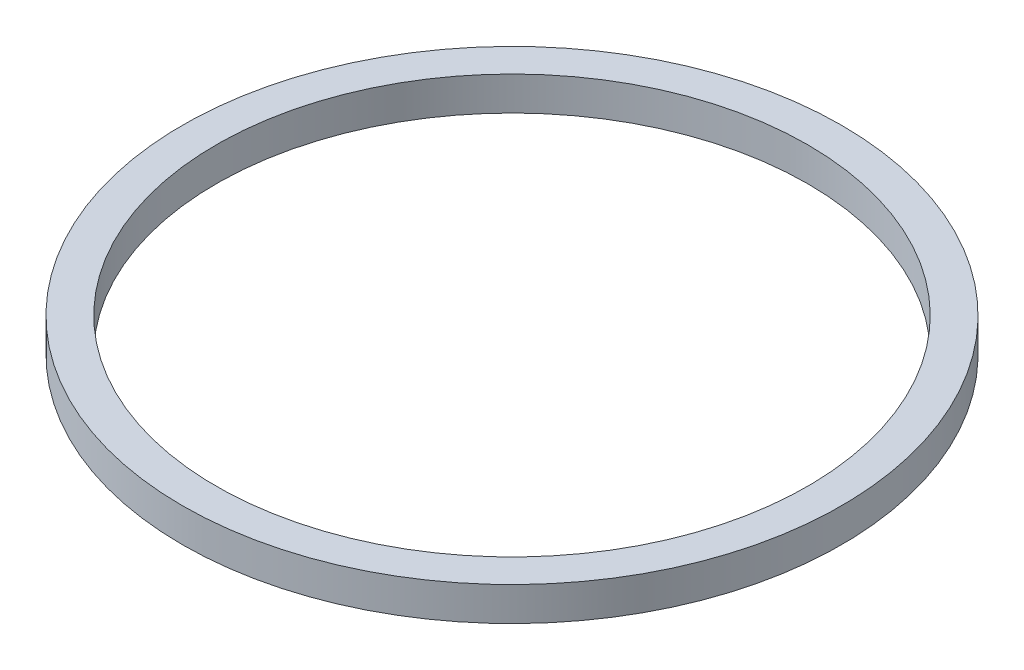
SolidWorks part; units mm, degrees
ref_plane "Front" through (0, 0, 0) normal (0, 0, 1) x (1, 0, 0)
ref_plane "Top" through (0, 0, 0) normal (0, 1, 0) x (1, 0, 0)
ref_plane "Right" through (0, 0, 0) normal (1, 0, 0) x (0, 0, -1)
sketch "Sketch1" plane through (0, 0, 0) normal (0, 0, 1) x (1, 0, 0)
  line L0 (0, 0) -> (0, 36.9957) construction
  line L2 (70, 8) -> (78, 8)
  line L3 (70, 8) -> (70, 0)
  line L4 (70, 0) -> (78, 0)
  line L5 (78, 8) -> (78, 0)
  dimension "D1" = 8
  dimension "D2" = 70
  dimension "D3" = 78
revolve "Revolve1" add sketch "Sketch1" angle 360 about L0
